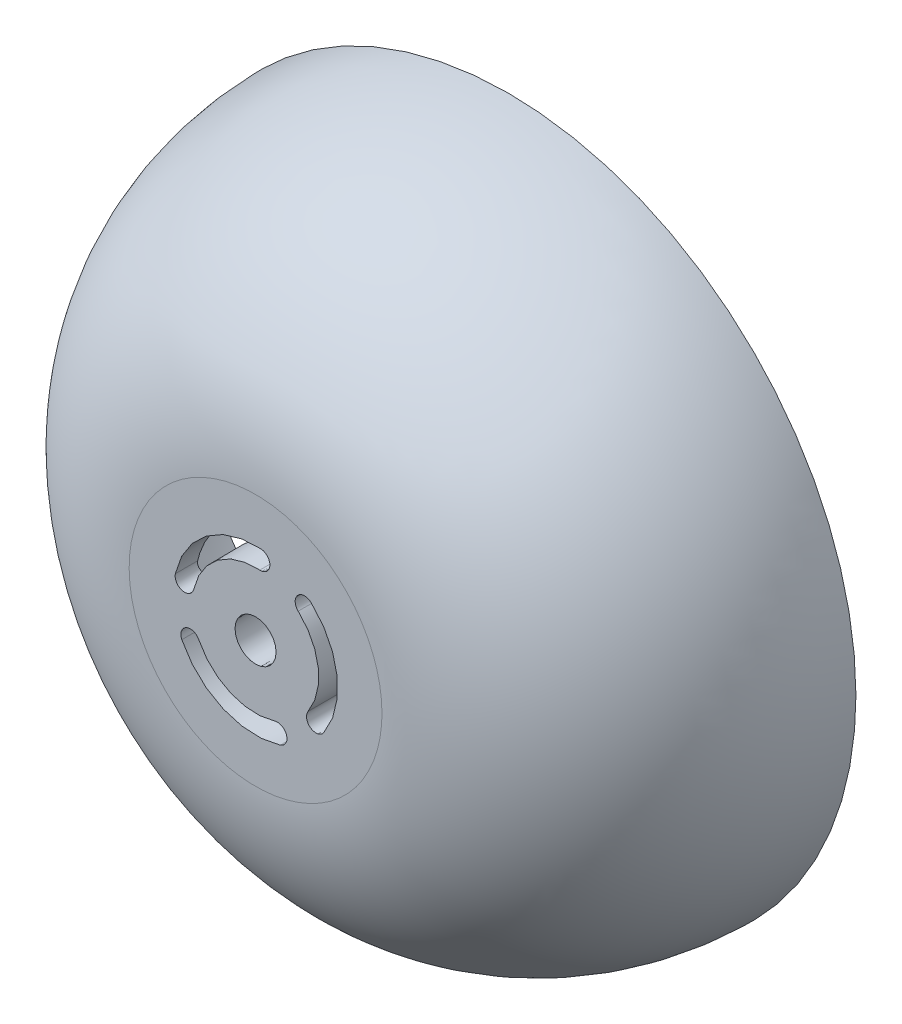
SolidWorks part; units mm, degrees
ref_plane "Plan de face" through (0, 0, 0) normal (0, 0, 1) x (1, 0, 0)
ref_plane "Plan de dessus" through (0, 0, 0) normal (0, 1, 0) x (1, 0, 0)
ref_plane "Plan de droite" through (0, 0, 0) normal (1, 0, 0) x (0, 0, -1)
sketch "Esquisse1" plane through (0, 0, 0) normal (0, 0, 1) x (1, 0, 0)
  circle A0 centre (0, 0) radius 55
  dimension "D1" = 110
extrude "Boss.-Extru.1" add sketch "Esquisse1" along normal blind 40
fillet "Congé1" radius 40 1 edges at (55, 0, 40)
sketch "Esquisse2" plane through (0, 0, 0) normal (0, 0, -1) x (-1, 0, 0)
  circle A0 centre (0, 0) radius 50
  dimension "D1" = 100
extrude "Enlèv. mat.-Extru.1" cut sketch "Esquisse2" against normal blind 12.5
fillet "Congé2" radius 5 1 edges at (-50, 0, 12.5)
sketch "Esquisse3" plane through (0, 0, 40) normal (0, 0, 1) x (1, 0, 0)
  circle A0 centre (0, 0) radius 3.25
  dimension "D1" = 6.5
extrude "Enlèv. mat.-Extru.2" cut sketch "Esquisse3" against normal through all
sketch "Esquisse5" plane through (0, 0, 12.5) normal (0, 0, -1) x (-1, 0, 0)
  circle A0 centre (0, 0) radius 45
  dimension "D1" = 90
extrude "Enlèv. mat.-Extru.4" cut sketch "Esquisse5" against normal blind 15
shell "Coque1" thickness 3
sketch "Esquisse6" plane through (0, 0, 40) normal (0, 0, 1) x (1, 0, 0)
  arc A0 (-11.2307, 2.4742) -> (0.7705, 11.4742) centre (0, 0) cw construction
  arc A1 (0.871, 12.9708) -> (-12.6956, 2.7969) centre (0, 0) ccw
  arc A2 (0.67, 9.9775) -> (-9.7658, 2.1514) centre (0, 0) ccw
  arc A3 (0.67, 9.9775) -> (0.871, 12.9708) centre (0.7705, 11.4742) ccw
  arc A4 (-12.6956, 2.7969) -> (-9.7658, 2.1514) centre (-11.2307, 2.4742) ccw
  arc A5 (7.758, 8.489) -> (9.5517, -6.4043) centre (0, 0) cw construction
  arc A6 (10.7975, -7.2397) -> (8.77, 9.5962) centre (0, 0) ccw
  arc A7 (8.3058, -5.569) -> (6.7461, 7.3817) centre (0, 0) ccw
  arc A8 (8.3058, -5.569) -> (10.7975, -7.2397) centre (9.5517, -6.4043) ccw
  arc A9 (8.77, 9.5962) -> (6.7461, 7.3817) centre (7.758, 8.489) ccw
  arc A10 (3.4727, -10.9631) -> (-10.3222, -5.0698) centre (0, 0) cw construction
  arc A11 (-11.6685, -5.7311) -> (3.9256, -12.3931) centre (0, 0) ccw
  arc A12 (-8.9758, -4.4085) -> (3.0197, -9.5332) centre (0, 0) ccw
  arc A13 (-8.9758, -4.4085) -> (-11.6685, -5.7311) centre (-10.3222, -5.0698) ccw
  arc A14 (3.9256, -12.3931) -> (3.0197, -9.5332) centre (3.4727, -10.9631) ccw
  point P4 (-6.8996, 9.2003)
  point P14 (11.4175, 1.375)
  point P21 (-4.5179, -10.5754)
  point P26 (0, 0)
  dimension "D1" = 3
  dimension "D2" = 10
  dimension "D3" = 13
  dimension "D4" = 9
  dimension "D5" = 8
extrude "Enlèv. mat.-Extru.5" cut sketch "Esquisse6" against normal blind 3
fillet "Congé3" radius 10 1 edges at (6.25, 0, 37)
